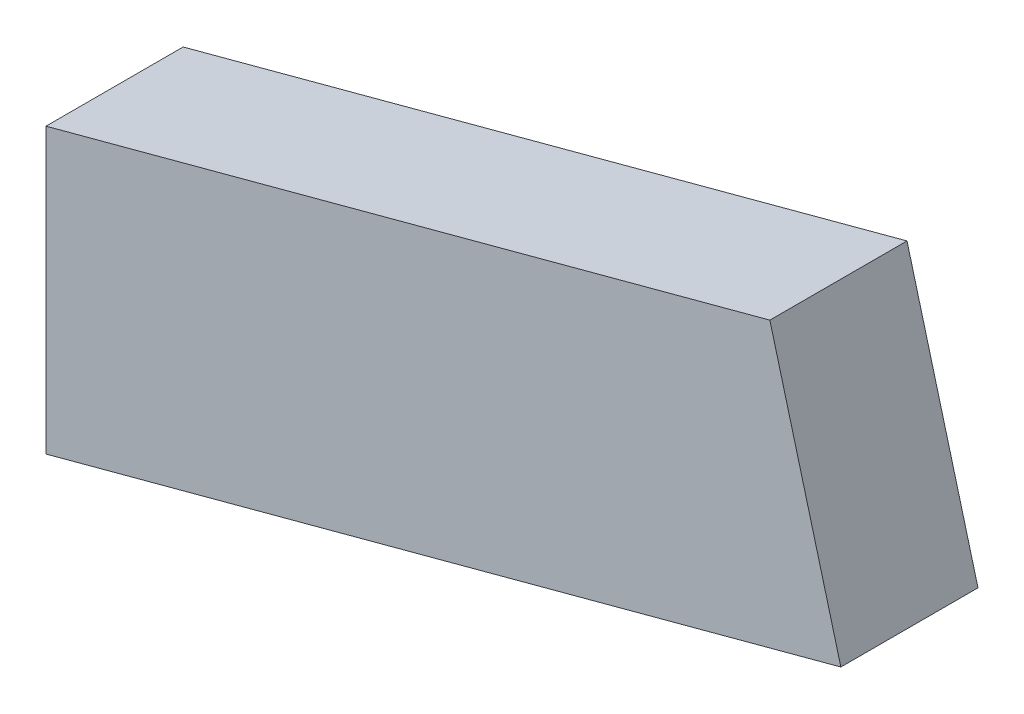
SolidWorks part; units mm, degrees
ref_plane "Front Plane" through (0, 0, 0) normal (0, 0, 1) x (1, 0, 0)
ref_plane "Top Plane" through (0, 0, 0) normal (0, 1, 0) x (1, 0, 0)
ref_plane "Right Plane" through (0, 0, 0) normal (1, 0, 0) x (0, 0, -1)
sketch "Sketch1" plane through (0, 0, 0) normal (0, 0, 1) x (1, 0, 0)
  line L0 (0, 0) -> (73.6035, 19.722)
  line L1 (73.6035, 19.722) -> (67.0295, 44.2565)
  line L2 (67.0295, 44.2565) -> (0, 26.296)
  line L3 (0, 26.296) -> (0, 0)
  dimension "D1" = 76.2
  dimension "D2" = 25.4
  dimension "D3" = 75
extrude "Extrude1" add sketch "Sketch1" along normal blind 12.7
